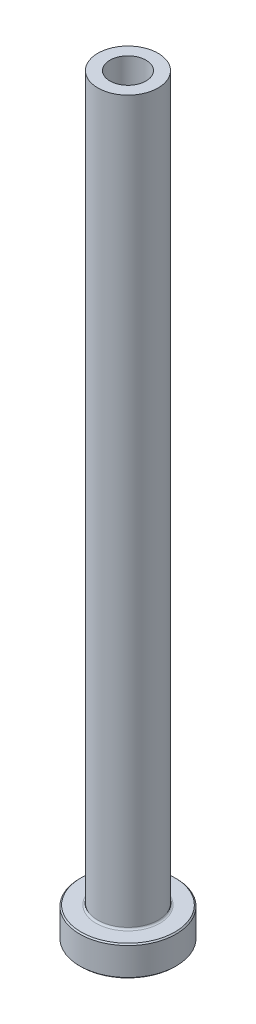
SolidWorks part; units mm, degrees
ref_plane "Front Plane" through (0, 0, 0) normal (0, 0, 1) x (1, 0, 0)
ref_plane "Top Plane" through (0, 0, 0) normal (0, 1, 0) x (1, 0, 0)
ref_plane "Right Plane" through (0, 0, 0) normal (1, 0, 0) x (0, 0, -1)
sketch "Sketch1" plane through (0, 0, 0) normal (0, 0, 1) x (1, 0, 0)
  line L0 (-3, 125) -> (-5, 125)
  line L1 (-5, 125) -> (-5, 5)
  line L2 (-5, 5) -> (-8, 5)
  line L3 (-8, 5) -> (-8, 0)
  line L4 (8.8, 0) -> (-8.8, 0) construction
  line L5 (-8, 0) -> (-3.25, 0)
  line L6 (-3, 80) -> (-3, 125)
  line L7 (0, 92.1877) -> (0, -15.5353) construction
  line L8 (0, -8.8) -> (0, 8.8) construction
  line L9 (-3, 80) -> (-3.25, 68)
  line L10 (-3.25, 68) -> (-3.25, 0)
  dimension "D1" = 0.25
  dimension "ID" = 6
  dimension "OD" = 10
  dimension "L" = 125
  dimension "H" = 16
  dimension "T" = 5
  dimension "N" = 45
  dimension "D2" = 12
revolve "Revolve1" add sketch "Sketch1" angle 360 about L7
fillet "Fillet1" radius 0.3 1 edges at (0, 5, 5)
chamfer "Chamfer1" distance 0.2 angle 45 2 edges at (0, 5, 8) (0, 0, 8)
chamfer "Chamfer3" distance 0.5 angle 45 1 edges at (0, 0, 3.25)
